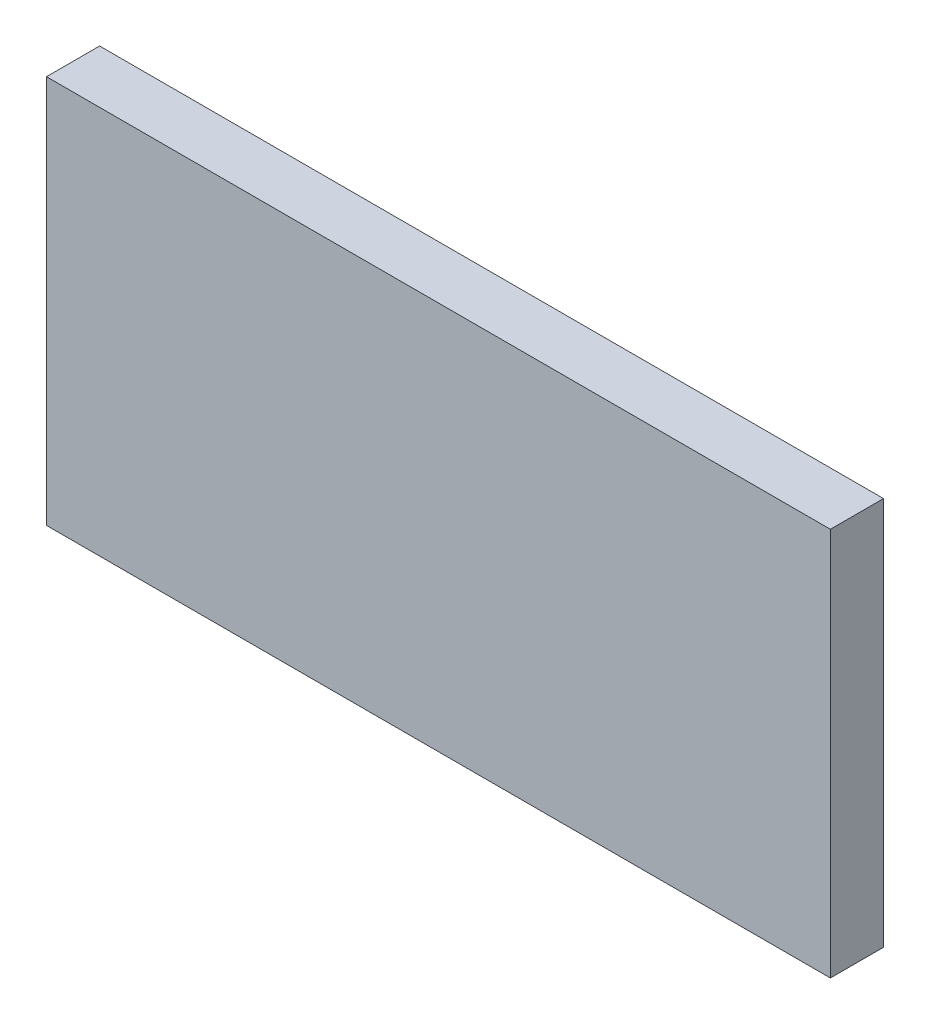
SolidWorks part; units mm, degrees
ref_plane "Front Plane" through (0, 0, 0) normal (0, 0, 1) x (1, 0, 0)
ref_plane "Top Plane" through (0, 0, 0) normal (0, 1, 0) x (1, 0, 0)
ref_plane "Right Plane" through (0, 0, 0) normal (1, 0, 0) x (0, 0, -1)
sketch "Sketch1" plane through (0, 0, 0) normal (0, 0, 1) x (1, 0, 0)
  line L1 (0, 0) -> (59.944, 0)
  line L2 (0, 0) -> (0, 29.718)
  line L3 (0, 29.718) -> (59.944, 29.718)
  line L4 (59.944, 0) -> (59.944, 29.718)
  dimension "D1" = 59.944
  dimension "D2" = 29.718
extrude "Boss-Extrude1" add sketch "Sketch1" along normal blind 4.064
